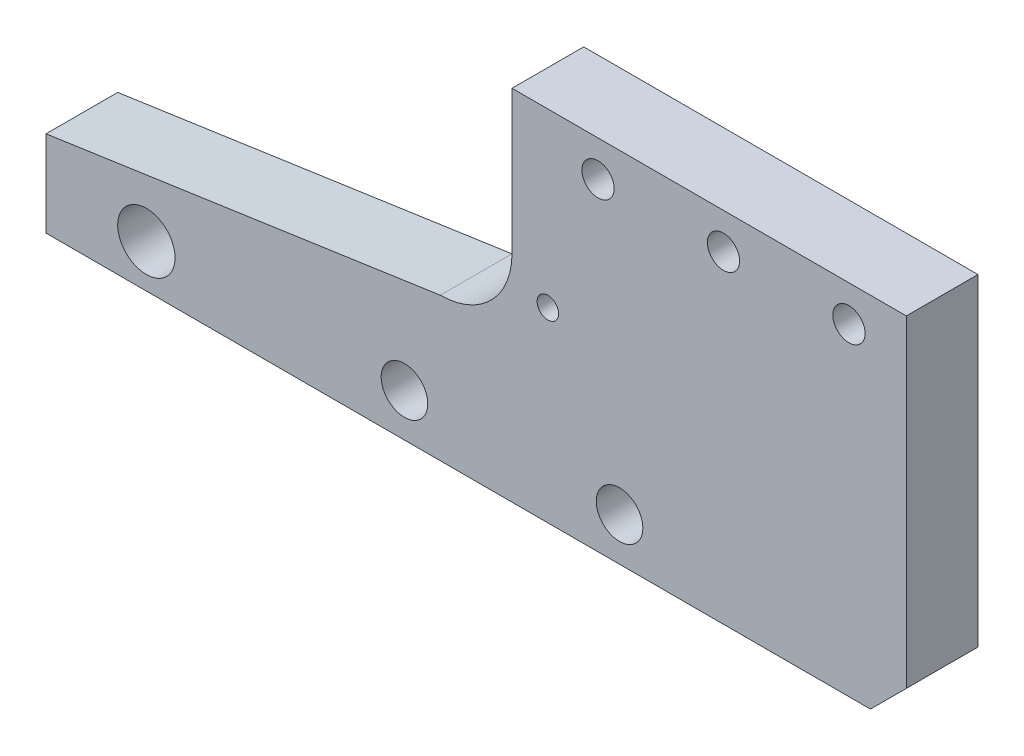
SolidWorks part; units mm, degrees
other "Objet de détail2"
ref_plane "Face" through (0, 0, 0) normal (0, 0, 1) x (1, 0, 0)
ref_plane "Dessus" through (0, 0, 0) normal (0, 1, 0) x (1, 0, 0)
ref_plane "Droite" through (0, 0, 0) normal (1, 0, 0) x (0, 0, -1)
sketch "Esquisse1" plane through (0, 0, 0) normal (0, 0, 1) x (1, 0, 0)
  line L1 (120, -20) -> (0, -20)
  line L2 (120, -20) -> (120, 30)
  line L3 (120, 30) -> (65, 30)
  line L4 (0, -20) -> (0, 0)
  line L5 (65, 0) -> (0, 0)
  line L6 (65, 0) -> (65, 30)
  circle A0 centre (80, -14) radius 3.25
  circle A1 centre (50, -14) radius 3.25
  circle A2 centre (14, -14) radius 4
  circle A3 centre (70, 6) radius 1.5
  dimension "D5" = 30
  dimension "D6" = 66
  dimension "D8" = 6.5
  dimension "D9" = 24
  dimension "D10" = 8
  dimension "D4" = 14
  dimension "D11" = 20
  dimension "D12" = 10
  dimension "D13" = 3
  dimension "D14" = 5
  dimension "D2" = 120
  dimension "D3" = 20
  dimension "D7" = 50
extrude "Extrusion1" add sketch "Esquisse1" along normal blind 10
hole_wizard "Chambrage pour vis à tête hexagonale M41" positions "Esquisse4" profile "Esquisse3" counterbore size "M4" standard "ISO"
sketch "Esquisse4" plane through (-1.4242, -19.8719, 0) normal (0, 0, 1) x (1, 0, 0)
  line L0 (78.4242, 44.8719) -> (113.4242, 44.8719) construction
  line L2 (121.4242, 49.8719) -> (66.4242, 49.8719) construction
  circle A1 centre (71.4242, 25.8719) radius 1.5 construction
  point P0 (78.4242, 44.8719)
  point P1 (113.4242, 44.8719)
  point P8 (95.9242, 44.8719)
  dimension "D1" = 7
  dimension "D2" = 35
  dimension "D3" = 5
sketch "Esquisse3" plane through (77, 25, 0) normal (1, 0, 0) x (0, 1, 0)
  line L0 (0, 0) -> (0, 10)
  line L1 (0, 10) -> (2.25, 10)
  line L3 (2.25, 10) -> (2.25, 4)
  line L4 (2.25, 4) -> (4, 4)
  line L5 (4, 4) -> (4, 0)
  line L7 (4, 0) -> (0, 0)
  line L11 (0, -6.35) -> (0, 107.95) construction
  dimension "Diamètre du perçage jusqu'au prochain" = 4.5
  dimension "Profondeur du perçage jusqu'au prochain" = 10
  dimension "Diamètre du chambrage" = 8
  dimension "Profondeur du chambrage" = 4
fillet "Congé1" radius 10 1 edges at (65, 0, 5)
sketch "Esquisse5" plane through (0, 0, 10) normal (0, 0, 1) x (1, 0, 0)
  line L0 (55, 0) -> (0, -8)
  line L1 (0, 0) -> (0, -20) construction
  line L2 (55, 0) -> (0, 0) construction
  arc A0 (55, 0) -> (65, 10) centre (55, 10) ccw construction
  dimension "D1" = 8
extrude "Enlèv. mat.-Extru.1" cut sketch "Esquisse5" against normal through all and the other way through all flip side to cut
chamfer "Chanfrein1" distance 5 angle 45 1 edges at (120, -20, 5)
